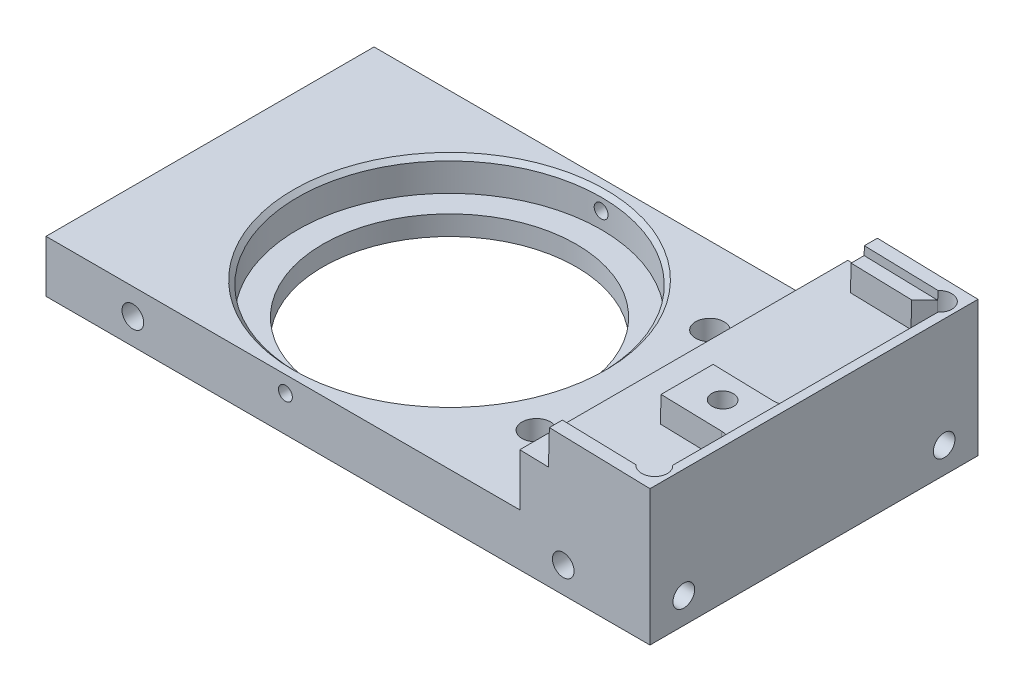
SolidWorks part; units mm, degrees
ref_plane "Front" through (0, 0, 0) normal (0, 0, 1) x (1, 0, 0)
ref_plane "Top" through (0, 0, 0) normal (0, 1, 0) x (1, 0, 0)
ref_plane "Right" through (0, 0, 0) normal (1, 0, 0) x (0, 0, -1)
sketch "Sketch1" plane through (0, 0, 0) normal (0, 1, 0) x (1, 0, 0)
  line L0 (42, 0) -> (0, 0) construction
  line L1 (-30, 18.9) -> (42, 18.9)
  line L2 (-30, 18.9) -> (-30, -18.9)
  line L3 (-30, -18.9) -> (42, -18.9)
  line L4 (42, 18.9) -> (42, -18.9)
  dimension "D1" = 37.8
  dimension "D2" = 72
  dimension "D3" = 30
extrude "Extrude1" add sketch "Sketch1" along normal blind 5.9944
sketch "Sketch2" plane through (0, 5.9944, 0) normal (0, 1, 0) x (1, 0, 0)
  line L0 (-30, -18.9) -> (42, -18.9) construction
  line L1 (42, 18.9) -> (27, 18.9)
  line L2 (42, 18.9) -> (42, -18.9)
  line L3 (42, -18.9) -> (27, -18.9)
  line L4 (27, 18.9) -> (27, -18.9)
  line L5 (-30, 18.9) -> (-30, -18.9) construction
  dimension "D1" = 15
  dimension "D2" = 57
extrude "Extrude2" add sketch "Sketch2" along normal offset from surface (10.0056 mm away) 16
sketch "Sketch3" plane through (0, 0, 0) normal (0, 0, 1) x (1, 0, 0)
  line L0 (27, 16) -> (42, 15.6072)
  line L1 (42, 15.6072) -> (42, 16)
  line L2 (42, 16) -> (27, 16)
  line L3 (42, 16) -> (42, 0) construction
  line L4 (27, 16) -> (42, 16) construction
  line L5 (-30, 0) -> (42, 0) construction
  dimension "D1" = 15.6072
  dimension "D2" = 1.5
  dimension "D3" = 88.5
extrude "Extrude3" cut sketch "Sketch3" against normal through all and the other way through all
sketch "Sketch4" plane through (0, 0, 0) normal (0, -1, 0) x (1, 0, 0)
  line L0 (-30, -18.9) -> (-30, 18.9) construction
  line L1 (42, 18.9) -> (42, -18.9) construction
  line L2 (-30, -18.9) -> (-30, 18.9) construction
  circle A0 centre (0.0011, 0) radius 14.6
  dimension "D1" = 29.2
  dimension "D2" = 15.4011
  dimension "D3" = 41.9989
  dimension "D4" = 30.0011
extrude "Extrude4" cut sketch "Sketch4" against normal through all
sketch "Sketch7" plane through (0, 5.9944, 0) normal (0, 1, 0) x (1, 0, 0)
  circle A0 centre (0.0011, 0) radius 17.5
  dimension "D1" = 35
extrude "Extrude5" cut sketch "Sketch7" against normal blind 3.7338
hole_wizard "M4x0.7 Tapped Hole1" positions "Sketch6" profile "Sketch5" tap size "M4x0.7" standard "Ansi Metric"
sketch "Sketch6" plane through (0, 0, 0) normal (0, -1, 0) x (1, 0, 0)
  line L1 (-30, -18.9) -> (-30, 18.9) construction
  line L2 (42, 18.9) -> (42, -18.9) construction
  point P0 (20, 10)
  point P1 (20, -10)
  dimension "D1" = 50
  dimension "D2" = 10
  dimension "D3" = 20
  dimension "D4" = 22
sketch "Sketch5" plane through (20, 0, 10) normal (1, 0, 0) x (0, 0, -1)
  line L0 (0, 0) -> (0, 16.0003)
  line L1 (0, 16.0003) -> (1.65, 16.0003)
  line L2 (1.65, 16.0003) -> (1.65, 0)
  line L5 (1.65, 0) -> (0, 0)
  line L11 (0, -6.35) -> (0, 107.95) construction
  dimension "Thru Tap Drill Dia." = 3.3
  dimension "Thru Tap Drill Depth" = 16.0003
sketch "Sketch8" plane through (0.4372, 16.6956, 0) normal (0.0262, 0.9997, 0) x (0.9997, -0.0262, 0)
  line L0 (41.5771, -18.9) -> (26.5719, -18.9) construction
  line L1 (40.5771, 17.4) -> (24.2183, 17.4)
  line L2 (40.5771, 17.4) -> (40.5771, -17.4)
  line L3 (40.5771, -17.4) -> (24.2183, -17.4)
  line L4 (24.2183, -17.4) -> (24.2183, 17.4)
  line L5 (41.5771, 18.9) -> (41.5771, -18.9) construction
  line L9 (26.5719, 18.9) -> (41.5771, 18.9) construction
  dimension "D1" = 1.5
  dimension "D2" = 1
  dimension "D3" = 1.5
extrude "Extrude6" cut sketch "Sketch8" against normal blind 1
sketch "Sketch10" plane through (0.4372, 16.6956, 0) normal (0.0262, 0.9997, 0) x (0.9997, -0.0262, 0)
  line L0 (40.5771, -17.4) -> (40.5771, 17.4) construction
  line L1 (38.459, -17.4) -> (22.2945, -17.4)
  line L3 (40.5771, -15.282) -> (40.5771, -8.1)
  line L4 (40.5771, -17.4) -> (26.5719, -17.4) construction
  line L5 (-774.3321, -17.4001) -> (-774.3321, -18.9001) construction
  line L6 (41.9856, 18.9) -> (-29.9897, 18.9) construction
  line L7 (40.5771, 17.4) -> (26.5719, 17.4) construction
  line L9 (39.5771, 17.9) -> (324.5098, 17.9) construction
  line L10 (324.5098, 18.9) -> (324.5098, 16.9) construction
  line L11 (26.5719, 18.9) -> (41.5771, 18.9) construction
  line L12 (41.5771, 18.9) -> (41.5771, -18.9) construction
  line L14 (38.459, 17.4) -> (19.4791, 17.4) construction
  line L15 (38.459, 17.4) -> (36.959, 15.9)
  line L16 (36.959, 15.9) -> (22.2945, 15.9)
  line L17 (22.2945, 15.9) -> (22.2945, -17.4)
  line L18 (41.5771, -18.9) -> (26.5719, -18.9) construction
  line L19 (40.5771, -2.1) -> (32.0771, -2.1)
  line L20 (32.0771, -2.1) -> (32.0771, -8.1)
  line L21 (32.0771, -8.1) -> (40.5771, -8.1)
  line L22 (40.5771, -2.1) -> (40.5771, 15.282)
  arc A0 (38.459, -17.4) -> (40.5771, -15.282) centre (39.5771, -16.4) ccw
  arc A1 (40.5771, 15.282) -> (38.459, 17.4) centre (39.5771, 16.4) ccw
  dimension "D1" = 1.5
  dimension "D2" = 45
  dimension "D3" = 3
  dimension "D4" = 2
  dimension "D5" = 6
  dimension "D6" = 9.5
  dimension "D7" = 2.5
  dimension "D8" = 2
  dimension "D9" = 2.5
  dimension "D10" = 21
extrude "Extrude7" cut sketch "Sketch10" against normal offset from surface (4 mm away) 4
hole_wizard "M3x0.5 Tapped Hole2" positions "Sketch12" profile "Sketch11" tap size "M3x0.5" standard "Ansi Metric"
sketch "Sketch12" plane through (-30, 0, 0) normal (-1, 0, 0) x (0, 0, 1)
  line L0 (-18.9, 0) -> (18.9, 0) construction
  line L1 (-18.9, 5.9944) -> (18.9, 5.9944) construction
  point P0 (-15.0013, 2.9944)
  point P1 (14.9987, 2.9944)
  point P6 (0, 0)
  point P7 (0, 0)
  dimension "D1" = 2.9944
  dimension "D2" = 14.9987
  dimension "D3" = 30
  dimension "D4" = 15.0013
  dimension "D5" = 3
sketch "Sketch11" plane through (-30, 2.9944, -15.0013) normal (0, 1, 0) x (0, 0, 1)
  line L0 (0, 0) -> (0, 8.6251)
  line L1 (0, 8.6251) -> (1.25, 7.874)
  line L2 (1.25, 7.874) -> (1.25, 0)
  line L5 (1.25, 0) -> (0, 0)
  line L10 (0, 8.6251) -> (-1.25, 7.874) construction
  line L11 (0, -6.35) -> (0, 107.95) construction
  dimension "Tap Drill Dia." = 2.5
  dimension "Tap Drill Depth" = 7.874
  dimension "Drill Angle" = 118
hole_wizard "M3x0.5 Tapped Hole3" positions "Sketch14" profile "Sketch13" tap size "M3x0.5" standard "Ansi Metric"
sketch "Sketch14" plane through (0.411, 15.6959, 0) normal (0.0262, 0.9997, 0) x (-0.9997, 0.0262, 0)
  line L0 (-32.0771, 2.1) -> (-32.0771, 8.1) construction
  line L1 (-32.0771, 2.1) -> (-32.0771, 8.1) construction
  line L3 (-40.5771, 15.282) -> (-40.5771, -15.282) construction
  line L5 (-41.9856, 18.9) -> (-41.9856, -18.9) construction
  line L6 (-41.9856, -18.9) -> (29.9897, -18.9) construction
  point P0 (-36.0771, 5)
  dimension "D1" = 23.9
  dimension "D2" = 4.5
  dimension "D3" = 5.9085
sketch "Sketch13" plane through (36.4757, 14.7515, 5) normal (0, 0, 1) x (-0.9997, 0.0262, 0)
  line L0 (0, 0) -> (0, 9.8189)
  line L1 (0, 9.8189) -> (1.25, 9.0678)
  line L2 (1.25, 9.0678) -> (1.25, 0)
  line L5 (1.25, 0) -> (0, 0)
  line L10 (0, 9.8189) -> (-1.25, 9.0678) construction
  line L11 (0, -6.35) -> (0, 107.95) construction
  dimension "Tap Drill Dia." = 2.5
  dimension "Tap Drill Depth" = 9.0678
  dimension "Drill Angle" = 118
fillet "Fillet1" radius 1.5 2 edges at (40.9349, 13.1342, 2.1) (40.9349, 13.1342, 8.1)
chamfer "Chamfer1" distance 0.5 angle 45 1 edges at (0.0011, 5.9944, 17.5)
chamfer "Chamfer2" distance 0.5 angle 45 2 edges at (-30, 2.9972, 18.9) (-30, 2.9972, -18.9)
hole_wizard "M3x0.5 Tapped Hole5" positions "Sketch21" profile "Sketch20" tap size "M3x0.5" standard "Ansi Metric"
sketch "Sketch21" plane through (42, 0, 0) normal (1, 0, 0) x (0, 0, -1)
  line L1 (18.4, 5.9944) -> (-18.4, 5.9944) construction
  point P0 (-15, 2.9944)
  point P6 (15, 2.9944)
  dimension "D1" = 15
  dimension "D2" = 3
  dimension "D3" = 30
sketch "Sketch20" plane through (42, 2.9944, 15) normal (0, 1, 0) x (0, 0, -1)
  line L0 (0, 0) -> (0, 9.2511)
  line L1 (0, 9.2511) -> (1.25, 8.5)
  line L2 (1.25, 8.5) -> (1.25, 0)
  line L5 (1.25, 0) -> (0, 0)
  line L10 (0, 9.2511) -> (-1.25, 8.5) construction
  line L11 (0, -6.35) -> (0, 107.95) construction
  dimension "Tap Drill Dia." = 2.5
  dimension "Tap Drill Depth" = 8.5
  dimension "Drill Angle" = 118
hole_wizard "M3x0.5 Tapped Hole4" positions "Sketch16" profile "Sketch15" tap size "M3x0.5" standard "Ansi Metric"
sketch "Sketch16" plane through (0, 0, 18.9) normal (0, 0, 1) x (1, 0, 0)
  line L0 (-30, 5.9944) -> (-30, 0) construction
  line L1 (-29.5, 0) -> (42, 0) construction
  line L2 (42, 15.6072) -> (42, 0) construction
  point P0 (-17.5884, 2.9972)
  point P3 (32.0051, 2.9972)
  dimension "D1" = 12.4116
  dimension "D2" = 2.9972
  dimension "D3" = 49.5935
  dimension "D4" = 9.9949
sketch "Sketch15" plane through (-17.5884, 2.9972, 18.9) normal (1, 0, 0) x (0, -1, 0)
  line L0 (0, 0) -> (0, 9.8189)
  line L1 (0, 9.8189) -> (1.25, 9.0678)
  line L2 (1.25, 9.0678) -> (1.25, 0)
  line L5 (1.25, 0) -> (0, 0)
  line L10 (0, 9.8189) -> (-1.25, 9.0678) construction
  line L11 (0, -6.35) -> (0, 107.95) construction
  dimension "Tap Drill Dia." = 2.5
  dimension "Tap Drill Depth" = 9.0678
  dimension "Drill Angle" = 118
hole_wizard "M2x0.4 Tapped Hole1" positions "Sketch19" profile "Sketch18" tap size "M2x0.4" standard "Ansi Metric"
sketch "Sketch19" plane through (0, 0, 18.9) normal (0, 0, 1) x (1, 0, 0)
  line L0 (-29.5, 5.9944) -> (27, 5.9944) construction
  line L1 (42, 15.6072) -> (42, 0) construction
  line L2 (-29.5, 0) -> (42, 0) construction
  point P0 (-0.0116, 4.1275)
  dimension "D1" = 1.8669
  dimension "D2" = 42.0116
  dimension "D3" = 4.1275
sketch "Sketch18" plane through (-0.0116, 4.1275, 18.9) normal (1, 0, 0) x (0, -1, 0)
  line L0 (0, 0) -> (0, 37.8)
  line L1 (0, 37.8) -> (0.8, 37.8)
  line L2 (0.8, 37.8) -> (0.8, 0)
  line L5 (0.8, 0) -> (0, 0)
  line L11 (0, -6.35) -> (0, 107.95) construction
  dimension "Thru Tap Drill Dia." = 1.6
  dimension "Thru Tap Drill Depth" = 37.8
mirror "Mirror1" about plane through (0, 0, 0) normal (0, 0, 1) of "M2x0.4 Tapped Hole1", "M3x0.5 Tapped Hole4"
sketch "Sketch17" plane through (0.3325, 12.6969, 0) normal (0.0262, 0.9997, 0) x (0.9997, -0.0262, 0)
  line L0 (26.6767, -17.4) -> (26.6767, 15.9) construction
  line L1 (15.4947, 25.1634) -> (29.9787, 25.1634)
  line L2 (15.4947, 25.1634) -> (15.4947, -27.3211)
  line L3 (15.4947, -27.3211) -> (29.9787, -27.3211)
  line L4 (29.9787, 25.1634) -> (29.9787, -27.3211)
  dimension "D1" = 3.302
extrude "Extrude8" cut sketch "Sketch17" along normal through all
sketch "Sketch22" plane through (0, 0, 0) normal (0, 1, 0) x (1, 0, 0)
  line L0 (42, -18.9) -> (42, 18.9) construction
  line L1 (-37.5614, 23.8074) -> (-27.6, 23.8074)
  line L2 (-37.5614, 23.8074) -> (-37.5614, -25.7513)
  line L3 (-37.5614, -25.7513) -> (-27.6, -25.7513)
  line L4 (-27.6, 23.8074) -> (-27.6, -25.7513)
  dimension "D1" = 69.6
extrude "Extrude9" cut sketch "Sketch22" along normal through all
